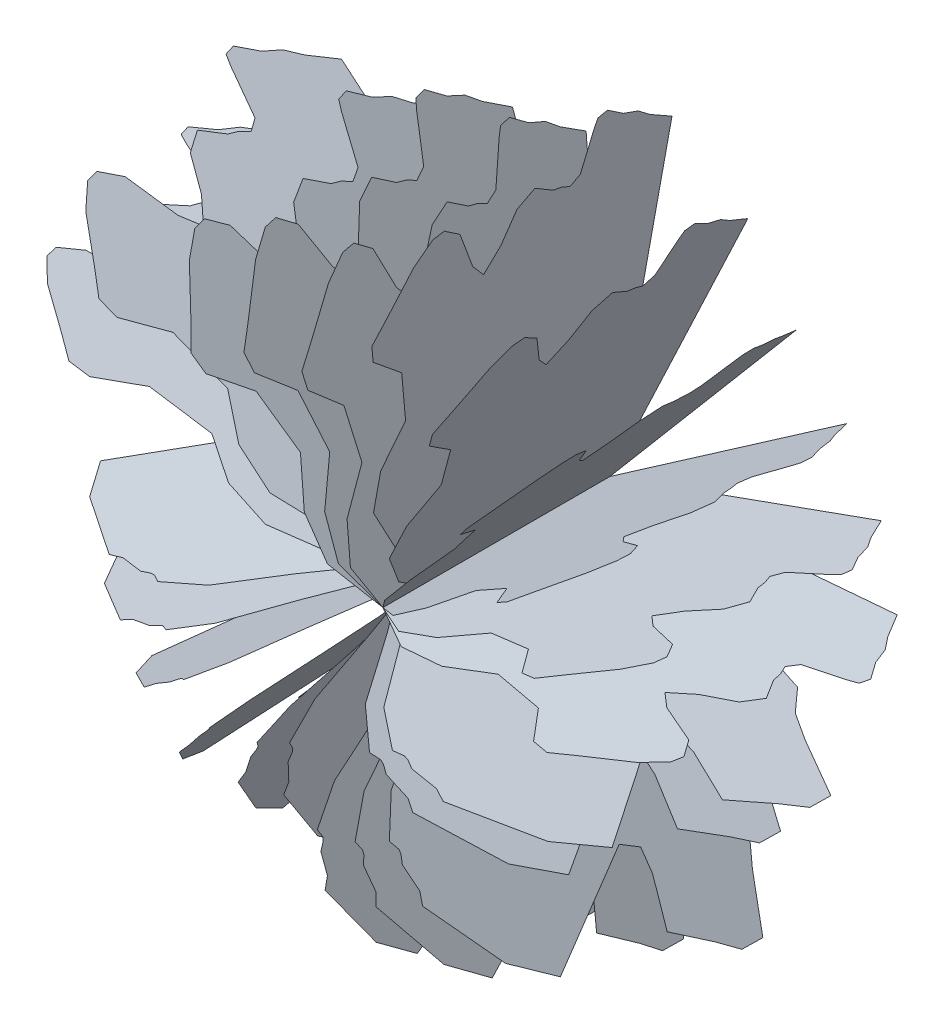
SolidWorks part; units mm, degrees
ref_plane "Front Plane" through (0, 0, 0) normal (0, 0, 1) x (1, 0, 0)
ref_plane "Top Plane" through (0, 0, 0) normal (0, 1, 0) x (1, 0, 0)
ref_plane "Right Plane" through (0, 0, 0) normal (1, 0, 0) x (0, 0, -1)
ref_plane "Plane1" through (25.384, -21.4943, 0) normal (0.7632, -0.6462, 0) x (0, 0, -1)
sketch "Sketch1" plane through (25.384, -21.4943, 0) normal (0.7632, -0.6462, 0) x (0, 0, -1)
  line L0 (-159.9173, 52.2955) -> (-110.809, -28.5095)
  line L1 (-110.809, -28.5095) -> (-61.5155, -70.8588)
  line L2 (-61.5155, -70.8588) -> (-72.0441, -99.0921)
  line L3 (-72.0441, -99.0921) -> (-128.3149, -144.876)
  line L4 (-128.3149, -144.876) -> (-205.5747, -201.1164)
  line L5 (-205.5747, -201.1164) -> (-226.6435, -234.5912)
  line L6 (-226.6435, -234.5912) -> (-236.1321, -249.6671)
  line L7 (-236.1321, -249.6671) -> (-228.7832, -262.4161)
  line L8 (-228.7832, -262.4161) -> (-228.7749, -268.1552)
  line L9 (-228.7749, -268.1552) -> (-233.0466, -279.6201)
  line L10 (-233.0466, -279.6201) -> (-225.8445, -314.1837)
  line L11 (-225.8445, -314.1837) -> (-230.772, -330.6846)
  line L12 (-230.772, -330.6846) -> (-228.078, -334.5422)
  line L13 (-228.078, -334.5422) -> (-221.2419, -344.3309)
  line L14 (-221.2419, -344.3309) -> (-159.963, -432.0771)
  line L15 (-159.963, -432.0771) -> (-99.8786, -475.5205)
  line L16 (-99.8786, -475.5205) -> (45.4329, -380.4379)
  line L17 (45.4329, -380.4379) -> (70.408, -394.9623)
  line L18 (70.408, -394.9623) -> (70.5248, -427.1845)
  line L19 (70.5248, -427.1845) -> (56.4876, -491.5695)
  line L20 (56.4876, -491.5695) -> (110.2067, -528.1195)
  line L21 (110.2067, -528.1195) -> (138.9491, -550.0691)
  line L22 (138.9491, -550.0691) -> (171.2269, -550.4743)
  line L23 (171.2269, -550.4743) -> (195.9591, -478.7357)
  line L24 (195.9591, -478.7357) -> (210.1304, -446.511)
  line L25 (210.1304, -446.511) -> (236.1321, -421.7251)
  line L26 (236.1321, -421.7251) -> (236.1321, 380.4546)
  line L27 (236.1321, 380.4546) -> (236.1321, 426.0548)
  line L28 (236.1321, 426.0548) -> (197.7901, 450.0431)
  line L29 (197.7901, 450.0431) -> (176.4891, 467.2599)
  line L30 (176.4891, 467.2599) -> (151.7295, 477.4388)
  line L31 (151.7295, 477.4388) -> (123.4376, 498.0046)
  line L32 (123.4376, 498.0046) -> (109.3729, 494.3557)
  line L33 (109.3729, 494.3557) -> (105.9135, 480.3923)
  line L34 (105.9135, 480.3923) -> (95.6147, 417.5599)
  line L35 (95.6147, 417.5599) -> (81.5753, 406.9565)
  line L36 (81.5753, 406.9565) -> (67.4773, 413.7893)
  line L37 (67.4773, 413.7893) -> (53.4036, 417.1321)
  line L38 (53.4036, 417.1321) -> (21.7401, 437.6934)
  line L39 (21.7401, 437.6934) -> (-2.7565, 420.0423)
  line L40 (-2.7565, 420.0423) -> (-20.1735, 374.6204)
  line L41 (-20.1735, 374.6204) -> (-41.1314, 343.0823)
  line L42 (-41.1314, 343.0823) -> (-62.1738, 367.2764)
  line L43 (-62.1738, 367.2764) -> (-93.6962, 432.9968)
  line L44 (-93.6962, 432.9968) -> (-121.5999, 453.5027)
  line L45 (-121.5999, 453.5027) -> (-139.0074, 449.8463)
  line L46 (-139.0074, 449.8463) -> (-163.3607, 421.8671)
  line L47 (-163.3607, 421.8671) -> (-194.6789, 362.6158)
  line L48 (-194.6789, 362.6158) -> (-212.0825, 331.2299)
  line L49 (-212.0825, 331.2299) -> (-205.1542, 303.4944)
  line L50 (-205.1542, 303.4944) -> (-152.9209, 258.6149)
  line L51 (-152.9209, 258.6149) -> (-131.9461, 174.9538)
  line L52 (-131.9461, 174.9538) -> (-159.9114, 115.3737)
  line L53 (-159.9114, 115.3737) -> (-159.9173, 52.2955)
surface "Surface-Plane1" sketch "Sketch1"
ref_plane "Plane2" through (3.1514, -37.9805, 0) normal (0.0827, -0.9966, 0) x (-0.9966, -0.0827, 0)
sketch "Sketch2" plane through (3.1514, -37.9805, 0) normal (0.0827, -0.9966, 0) x (-0.9966, -0.0827, 0)
  line L0 (-81.8591, -159.9173) -> (-1.0541, -110.809)
  line L1 (-1.0541, -110.809) -> (41.2952, -61.5155)
  line L2 (41.2952, -61.5155) -> (69.5285, -72.0441)
  line L3 (69.5285, -72.0441) -> (115.3124, -128.3149)
  line L4 (115.3124, -128.3149) -> (171.5528, -205.5747)
  line L5 (171.5528, -205.5747) -> (205.0276, -226.6435)
  line L6 (205.0276, -226.6435) -> (220.1035, -236.1321)
  line L7 (220.1035, -236.1321) -> (232.8525, -228.7832)
  line L8 (232.8525, -228.7832) -> (238.5916, -228.7749)
  line L9 (238.5916, -228.7749) -> (250.0565, -233.0466)
  line L10 (250.0565, -233.0466) -> (284.6201, -225.8445)
  line L11 (284.6201, -225.8445) -> (301.121, -230.772)
  line L12 (301.121, -230.772) -> (304.9786, -228.078)
  line L13 (304.9786, -228.078) -> (314.7673, -221.2419)
  line L14 (314.7673, -221.2419) -> (402.5135, -159.963)
  line L15 (402.5135, -159.963) -> (445.9569, -99.8786)
  line L16 (445.9569, -99.8786) -> (350.8743, 45.4329)
  line L17 (350.8743, 45.4329) -> (365.3987, 70.408)
  line L18 (365.3987, 70.408) -> (397.6209, 70.5248)
  line L19 (397.6209, 70.5248) -> (462.0059, 56.4876)
  line L20 (462.0059, 56.4876) -> (498.5559, 110.2067)
  line L21 (498.5559, 110.2067) -> (520.5055, 138.9491)
  line L22 (520.5055, 138.9491) -> (520.9107, 171.2269)
  line L23 (520.9107, 171.2269) -> (449.1721, 195.9591)
  line L24 (449.1721, 195.9591) -> (416.9474, 210.1304)
  line L25 (416.9474, 210.1304) -> (392.1615, 236.1321)
  line L26 (392.1615, 236.1321) -> (-410.0182, 236.1321)
  line L27 (-410.0182, 236.1321) -> (-455.6184, 236.1321)
  line L28 (-455.6184, 236.1321) -> (-479.6068, 197.7901)
  line L29 (-479.6068, 197.7901) -> (-496.8235, 176.4891)
  line L30 (-496.8235, 176.4891) -> (-507.0024, 151.7295)
  line L31 (-507.0024, 151.7295) -> (-527.5682, 123.4376)
  line L32 (-527.5682, 123.4376) -> (-523.9194, 109.3729)
  line L33 (-523.9194, 109.3729) -> (-509.9559, 105.9135)
  line L34 (-509.9559, 105.9135) -> (-447.1236, 95.6147)
  line L35 (-447.1236, 95.6147) -> (-436.5201, 81.5753)
  line L36 (-436.5201, 81.5753) -> (-443.3529, 67.4773)
  line L37 (-443.3529, 67.4773) -> (-446.6957, 53.4036)
  line L38 (-446.6957, 53.4036) -> (-467.257, 21.7401)
  line L39 (-467.257, 21.7401) -> (-449.6059, -2.7565)
  line L40 (-449.6059, -2.7565) -> (-404.1841, -20.1735)
  line L41 (-404.1841, -20.1735) -> (-372.6459, -41.1314)
  line L42 (-372.6459, -41.1314) -> (-396.84, -62.1738)
  line L43 (-396.84, -62.1738) -> (-462.5604, -93.6962)
  line L44 (-462.5604, -93.6962) -> (-483.0663, -121.5999)
  line L45 (-483.0663, -121.5999) -> (-479.4099, -139.0074)
  line L46 (-479.4099, -139.0074) -> (-451.4307, -163.3607)
  line L47 (-451.4307, -163.3607) -> (-392.1794, -194.6789)
  line L48 (-392.1794, -194.6789) -> (-360.7935, -212.0825)
  line L49 (-360.7935, -212.0825) -> (-333.058, -205.1542)
  line L50 (-333.058, -205.1542) -> (-288.1785, -152.9209)
  line L51 (-288.1785, -152.9209) -> (-204.5174, -131.9461)
  line L52 (-204.5174, -131.9461) -> (-144.9373, -159.9114)
  line L53 (-144.9373, -159.9114) -> (-81.8591, -159.9173)
surface "Surface-Plane2" sketch "Sketch2"
ref_plane "Plane3" through (24.2269, -11.4297, 0) normal (0.9044, -0.4267, 0) x (0, 0, -1)
sketch "Sketch3" plane through (24.2269, -11.4297, 0) normal (0.9044, -0.4267, 0) x (0, 0, -1)
  line L0 (-159.9173, 98.6563) -> (-110.809, 17.8513)
  line L1 (-110.809, 17.8513) -> (-61.5155, -24.4981)
  line L2 (-61.5155, -24.4981) -> (-72.0441, -52.7313)
  line L3 (-72.0441, -52.7313) -> (-128.3149, -98.5152)
  line L4 (-128.3149, -98.5152) -> (-205.5747, -154.7556)
  line L5 (-205.5747, -154.7556) -> (-226.6435, -188.2305)
  line L6 (-226.6435, -188.2305) -> (-236.1321, -203.3063)
  line L7 (-236.1321, -203.3063) -> (-228.7832, -216.0553)
  line L8 (-228.7832, -216.0553) -> (-228.7749, -221.7945)
  line L9 (-228.7749, -221.7945) -> (-233.0466, -233.2593)
  line L10 (-233.0466, -233.2593) -> (-225.8445, -267.8229)
  line L11 (-225.8445, -267.8229) -> (-230.772, -284.3239)
  line L12 (-230.772, -284.3239) -> (-228.078, -288.1814)
  line L13 (-228.078, -288.1814) -> (-221.2419, -297.9701)
  line L14 (-221.2419, -297.9701) -> (-159.963, -385.7163)
  line L15 (-159.963, -385.7163) -> (-99.8786, -429.1597)
  line L16 (-99.8786, -429.1597) -> (45.4329, -334.0771)
  line L17 (45.4329, -334.0771) -> (70.408, -348.6016)
  line L18 (70.408, -348.6016) -> (70.5248, -380.8237)
  line L19 (70.5248, -380.8237) -> (56.4876, -445.2087)
  line L20 (56.4876, -445.2087) -> (110.2067, -481.7587)
  line L21 (110.2067, -481.7587) -> (138.9491, -503.7083)
  line L22 (138.9491, -503.7083) -> (171.2269, -504.1136)
  line L23 (171.2269, -504.1136) -> (195.9591, -432.375)
  line L24 (195.9591, -432.375) -> (210.1304, -400.1502)
  line L25 (210.1304, -400.1502) -> (236.1321, -375.3644)
  line L26 (236.1321, -375.3644) -> (236.1321, 426.8154)
  line L27 (236.1321, 426.8154) -> (236.1321, 472.4156)
  line L28 (236.1321, 472.4156) -> (197.7901, 496.4039)
  line L29 (197.7901, 496.4039) -> (176.4891, 513.6207)
  line L30 (176.4891, 513.6207) -> (151.7295, 523.7996)
  line L31 (151.7295, 523.7996) -> (123.4376, 544.3654)
  line L32 (123.4376, 544.3654) -> (109.3729, 540.7165)
  line L33 (109.3729, 540.7165) -> (105.9135, 526.7531)
  line L34 (105.9135, 526.7531) -> (95.6147, 463.9207)
  line L35 (95.6147, 463.9207) -> (81.5753, 453.3173)
  line L36 (81.5753, 453.3173) -> (67.4773, 460.15)
  line L37 (67.4773, 460.15) -> (53.4036, 463.4929)
  line L38 (53.4036, 463.4929) -> (21.7401, 484.0542)
  line L39 (21.7401, 484.0542) -> (-2.7565, 466.403)
  line L40 (-2.7565, 466.403) -> (-20.1735, 420.9812)
  line L41 (-20.1735, 420.9812) -> (-41.1314, 389.4431)
  line L42 (-41.1314, 389.4431) -> (-62.1738, 413.6372)
  line L43 (-62.1738, 413.6372) -> (-93.6962, 479.3576)
  line L44 (-93.6962, 479.3576) -> (-121.5999, 499.8635)
  line L45 (-121.5999, 499.8635) -> (-139.0074, 496.2071)
  line L46 (-139.0074, 496.2071) -> (-163.3607, 468.2279)
  line L47 (-163.3607, 468.2279) -> (-194.6789, 408.9765)
  line L48 (-194.6789, 408.9765) -> (-212.0825, 377.5907)
  line L49 (-212.0825, 377.5907) -> (-205.1542, 349.8552)
  line L50 (-205.1542, 349.8552) -> (-152.9209, 304.9757)
  line L51 (-152.9209, 304.9757) -> (-131.9461, 221.3145)
  line L52 (-131.9461, 221.3145) -> (-159.9114, 161.7345)
  line L53 (-159.9114, 161.7345) -> (-159.9173, 98.6563)
surface "Surface-Plane3" sketch "Sketch3"
ref_plane "Plane4" through (-9.3046, -6.4532, 0) normal (0.8217, 0.5699, 0) x (0, 0, -1)
sketch "Sketch4" plane through (-9.3046, -6.4532, 0) normal (0.8217, 0.5699, 0) x (0, 0, -1)
  line L0 (-159.9173, 35.4615) -> (-110.809, -45.3435)
  line L1 (-110.809, -45.3435) -> (-61.5155, -87.6928)
  line L2 (-61.5155, -87.6928) -> (-72.0441, -115.9261)
  line L3 (-72.0441, -115.9261) -> (-128.3149, -161.71)
  line L4 (-128.3149, -161.71) -> (-205.5747, -217.9504)
  line L5 (-205.5747, -217.9504) -> (-226.6435, -251.4252)
  line L6 (-226.6435, -251.4252) -> (-236.1321, -266.5011)
  line L7 (-236.1321, -266.5011) -> (-228.7832, -279.2501)
  line L8 (-228.7832, -279.2501) -> (-228.7749, -284.9892)
  line L9 (-228.7749, -284.9892) -> (-233.0466, -296.454)
  line L10 (-233.0466, -296.454) -> (-225.8445, -331.0177)
  line L11 (-225.8445, -331.0177) -> (-230.772, -347.5186)
  line L12 (-230.772, -347.5186) -> (-228.078, -351.3762)
  line L13 (-228.078, -351.3762) -> (-221.2419, -361.1649)
  line L14 (-221.2419, -361.1649) -> (-159.963, -448.911)
  line L15 (-159.963, -448.911) -> (-99.8786, -492.3545)
  line L16 (-99.8786, -492.3545) -> (45.4329, -397.2719)
  line L17 (45.4329, -397.2719) -> (70.408, -411.7963)
  line L18 (70.408, -411.7963) -> (70.5248, -444.0185)
  line L19 (70.5248, -444.0185) -> (56.4876, -508.4035)
  line L20 (56.4876, -508.4035) -> (110.2067, -544.9535)
  line L21 (110.2067, -544.9535) -> (138.9491, -566.9031)
  line L22 (138.9491, -566.9031) -> (171.2269, -567.3083)
  line L23 (171.2269, -567.3083) -> (195.9591, -495.5697)
  line L24 (195.9591, -495.5697) -> (210.1304, -463.345)
  line L25 (210.1304, -463.345) -> (236.1321, -438.5591)
  line L26 (236.1321, -438.5591) -> (236.1321, 363.6206)
  line L27 (236.1321, 363.6206) -> (236.1321, 409.2208)
  line L28 (236.1321, 409.2208) -> (197.7901, 433.2092)
  line L29 (197.7901, 433.2092) -> (176.4891, 450.4259)
  line L30 (176.4891, 450.4259) -> (151.7295, 460.6048)
  line L31 (151.7295, 460.6048) -> (123.4376, 481.1706)
  line L32 (123.4376, 481.1706) -> (109.3729, 477.5218)
  line L33 (109.3729, 477.5218) -> (105.9135, 463.5583)
  line L34 (105.9135, 463.5583) -> (95.6147, 400.726)
  line L35 (95.6147, 400.726) -> (81.5753, 390.1225)
  line L36 (81.5753, 390.1225) -> (67.4773, 396.9553)
  line L37 (67.4773, 396.9553) -> (53.4036, 400.2981)
  line L38 (53.4036, 400.2981) -> (21.7401, 420.8594)
  line L39 (21.7401, 420.8594) -> (-2.7565, 403.2083)
  line L40 (-2.7565, 403.2083) -> (-20.1735, 357.7865)
  line L41 (-20.1735, 357.7865) -> (-41.1314, 326.2483)
  line L42 (-41.1314, 326.2483) -> (-62.1738, 350.4424)
  line L43 (-62.1738, 350.4424) -> (-93.6962, 416.1628)
  line L44 (-93.6962, 416.1628) -> (-121.5999, 436.6687)
  line L45 (-121.5999, 436.6687) -> (-139.0074, 433.0123)
  line L46 (-139.0074, 433.0123) -> (-163.3607, 405.0331)
  line L47 (-163.3607, 405.0331) -> (-194.6789, 345.7818)
  line L48 (-194.6789, 345.7818) -> (-212.0825, 314.3959)
  line L49 (-212.0825, 314.3959) -> (-205.1542, 286.6604)
  line L50 (-205.1542, 286.6604) -> (-152.9209, 241.7809)
  line L51 (-152.9209, 241.7809) -> (-131.9461, 158.1198)
  line L52 (-131.9461, 158.1198) -> (-159.9114, 98.5397)
  line L53 (-159.9114, 98.5397) -> (-159.9173, 35.4615)
surface "Surface-Plane4" sketch "Sketch4"
ref_plane "Plane5" through (21.3537, -30.7891, 0) normal (0.5699, -0.8217, 0) x (-0.8217, -0.5699, 0)
sketch "Sketch5" plane through (21.3537, -30.7891, 0) normal (0.5699, -0.8217, 0) x (-0.8217, -0.5699, 0)
  line L0 (-61.6074, -159.9173) -> (19.1975, -110.809)
  line L1 (19.1975, -110.809) -> (61.5469, -61.5155)
  line L2 (61.5469, -61.5155) -> (89.7802, -72.0441)
  line L3 (89.7802, -72.0441) -> (135.564, -128.3149)
  line L4 (135.564, -128.3149) -> (191.8045, -205.5747)
  line L5 (191.8045, -205.5747) -> (225.2793, -226.6435)
  line L6 (225.2793, -226.6435) -> (240.3552, -236.1321)
  line L7 (240.3552, -236.1321) -> (253.1042, -228.7832)
  line L8 (253.1042, -228.7832) -> (258.8433, -228.7749)
  line L9 (258.8433, -228.7749) -> (270.3081, -233.0466)
  line L10 (270.3081, -233.0466) -> (304.8717, -225.8445)
  line L11 (304.8717, -225.8445) -> (321.3727, -230.772)
  line L12 (321.3727, -230.772) -> (325.2303, -228.078)
  line L13 (325.2303, -228.078) -> (335.019, -221.2419)
  line L14 (335.019, -221.2419) -> (422.7651, -159.963)
  line L15 (422.7651, -159.963) -> (466.2086, -99.8786)
  line L16 (466.2086, -99.8786) -> (371.1259, 45.4329)
  line L17 (371.1259, 45.4329) -> (385.6504, 70.408)
  line L18 (385.6504, 70.408) -> (417.8726, 70.5248)
  line L19 (417.8726, 70.5248) -> (482.2576, 56.4876)
  line L20 (482.2576, 56.4876) -> (518.8076, 110.2067)
  line L21 (518.8076, 110.2067) -> (540.7572, 138.9491)
  line L22 (540.7572, 138.9491) -> (541.1624, 171.2269)
  line L23 (541.1624, 171.2269) -> (469.4238, 195.9591)
  line L24 (469.4238, 195.9591) -> (437.1991, 210.1304)
  line L25 (437.1991, 210.1304) -> (412.4132, 236.1321)
  line L26 (412.4132, 236.1321) -> (-389.7665, 236.1321)
  line L27 (-389.7665, 236.1321) -> (-435.3667, 236.1321)
  line L28 (-435.3667, 236.1321) -> (-459.3551, 197.7901)
  line L29 (-459.3551, 197.7901) -> (-476.5718, 176.4891)
  line L30 (-476.5718, 176.4891) -> (-486.7507, 151.7295)
  line L31 (-486.7507, 151.7295) -> (-507.3165, 123.4376)
  line L32 (-507.3165, 123.4376) -> (-503.6677, 109.3729)
  line L33 (-503.6677, 109.3729) -> (-489.7042, 105.9135)
  line L34 (-489.7042, 105.9135) -> (-426.8719, 95.6147)
  line L35 (-426.8719, 95.6147) -> (-416.2684, 81.5753)
  line L36 (-416.2684, 81.5753) -> (-423.1012, 67.4773)
  line L37 (-423.1012, 67.4773) -> (-426.444, 53.4036)
  line L38 (-426.444, 53.4036) -> (-447.0053, 21.7401)
  line L39 (-447.0053, 21.7401) -> (-429.3542, -2.7565)
  line L40 (-429.3542, -2.7565) -> (-383.9324, -20.1735)
  line L41 (-383.9324, -20.1735) -> (-352.3942, -41.1314)
  line L42 (-352.3942, -41.1314) -> (-376.5883, -62.1738)
  line L43 (-376.5883, -62.1738) -> (-442.3087, -93.6962)
  line L44 (-442.3087, -93.6962) -> (-462.8146, -121.5999)
  line L45 (-462.8146, -121.5999) -> (-459.1582, -139.0074)
  line L46 (-459.1582, -139.0074) -> (-431.1791, -163.3607)
  line L47 (-431.1791, -163.3607) -> (-371.9277, -194.6789)
  line L48 (-371.9277, -194.6789) -> (-340.5418, -212.0825)
  line L49 (-340.5418, -212.0825) -> (-312.8063, -205.1542)
  line L50 (-312.8063, -205.1542) -> (-267.9269, -152.9209)
  line L51 (-267.9269, -152.9209) -> (-184.2657, -131.9461)
  line L52 (-184.2657, -131.9461) -> (-124.6856, -159.9114)
  line L53 (-124.6856, -159.9114) -> (-61.6074, -159.9173)
surface "Surface-Plane5" sketch "Sketch5"
ref_plane "Plane6" through (13.216, -36.8234, 0) normal (0.3378, -0.9412, 0) x (-0.9412, -0.3378, 0)
sketch "Sketch6" plane through (13.216, -36.8234, 0) normal (0.3378, -0.9412, 0) x (-0.9412, -0.3378, 0)
  line L0 (-71.691, -159.9173) -> (9.1139, -110.809)
  line L1 (9.1139, -110.809) -> (51.4633, -61.5155)
  line L2 (51.4633, -61.5155) -> (79.6966, -72.0441)
  line L3 (79.6966, -72.0441) -> (125.4804, -128.3149)
  line L4 (125.4804, -128.3149) -> (181.7209, -205.5747)
  line L5 (181.7209, -205.5747) -> (215.1957, -226.6435)
  line L6 (215.1957, -226.6435) -> (230.2716, -236.1321)
  line L7 (230.2716, -236.1321) -> (243.0206, -228.7832)
  line L8 (243.0206, -228.7832) -> (248.7597, -228.7749)
  line L9 (248.7597, -228.7749) -> (260.2245, -233.0466)
  line L10 (260.2245, -233.0466) -> (294.7881, -225.8445)
  line L11 (294.7881, -225.8445) -> (311.2891, -230.772)
  line L12 (311.2891, -230.772) -> (315.1467, -228.078)
  line L13 (315.1467, -228.078) -> (324.9354, -221.2419)
  line L14 (324.9354, -221.2419) -> (412.6815, -159.963)
  line L15 (412.6815, -159.963) -> (456.125, -99.8786)
  line L16 (456.125, -99.8786) -> (361.0423, 45.4329)
  line L17 (361.0423, 45.4329) -> (375.5668, 70.408)
  line L18 (375.5668, 70.408) -> (407.789, 70.5248)
  line L19 (407.789, 70.5248) -> (472.174, 56.4876)
  line L20 (472.174, 56.4876) -> (508.724, 110.2067)
  line L21 (508.724, 110.2067) -> (530.6736, 138.9491)
  line L22 (530.6736, 138.9491) -> (531.0788, 171.2269)
  line L23 (531.0788, 171.2269) -> (459.3402, 195.9591)
  line L24 (459.3402, 195.9591) -> (427.1155, 210.1304)
  line L25 (427.1155, 210.1304) -> (402.3296, 236.1321)
  line L26 (402.3296, 236.1321) -> (-399.8501, 236.1321)
  line L27 (-399.8501, 236.1321) -> (-445.4503, 236.1321)
  line L28 (-445.4503, 236.1321) -> (-469.4387, 197.7901)
  line L29 (-469.4387, 197.7901) -> (-486.6554, 176.4891)
  line L30 (-486.6554, 176.4891) -> (-496.8343, 151.7295)
  line L31 (-496.8343, 151.7295) -> (-517.4001, 123.4376)
  line L32 (-517.4001, 123.4376) -> (-513.7513, 109.3729)
  line L33 (-513.7513, 109.3729) -> (-499.7878, 105.9135)
  line L34 (-499.7878, 105.9135) -> (-436.9555, 95.6147)
  line L35 (-436.9555, 95.6147) -> (-426.352, 81.5753)
  line L36 (-426.352, 81.5753) -> (-433.1848, 67.4773)
  line L37 (-433.1848, 67.4773) -> (-436.5276, 53.4036)
  line L38 (-436.5276, 53.4036) -> (-457.0889, 21.7401)
  line L39 (-457.0889, 21.7401) -> (-439.4378, -2.7565)
  line L40 (-439.4378, -2.7565) -> (-394.016, -20.1735)
  line L41 (-394.016, -20.1735) -> (-362.4778, -41.1314)
  line L42 (-362.4778, -41.1314) -> (-386.6719, -62.1738)
  line L43 (-386.6719, -62.1738) -> (-452.3923, -93.6962)
  line L44 (-452.3923, -93.6962) -> (-472.8982, -121.5999)
  line L45 (-472.8982, -121.5999) -> (-469.2418, -139.0074)
  line L46 (-469.2418, -139.0074) -> (-441.2627, -163.3607)
  line L47 (-441.2627, -163.3607) -> (-382.0113, -194.6789)
  line L48 (-382.0113, -194.6789) -> (-350.6254, -212.0825)
  line L49 (-350.6254, -212.0825) -> (-322.8899, -205.1542)
  line L50 (-322.8899, -205.1542) -> (-278.0105, -152.9209)
  line L51 (-278.0105, -152.9209) -> (-194.3493, -131.9461)
  line L52 (-194.3493, -131.9461) -> (-134.7692, -159.9114)
  line L53 (-134.7692, -159.9114) -> (-71.691, -159.9173)
surface "Surface-Plane6" sketch "Sketch6"
ref_plane "Plane7" through (-1.1669, -0.4188, 0) normal (0.9412, 0.3378, 0) x (0, 0, -1)
sketch "Sketch7" plane through (-1.1669, -0.4188, 0) normal (0.9412, 0.3378, 0) x (0, 0, -1)
  line L0 (-159.9173, 33.8075) -> (-110.809, -46.9974)
  line L1 (-110.809, -46.9974) -> (-61.5155, -89.3468)
  line L2 (-61.5155, -89.3468) -> (-72.0441, -117.5801)
  line L3 (-72.0441, -117.5801) -> (-128.3149, -163.3639)
  line L4 (-128.3149, -163.3639) -> (-205.5747, -219.6044)
  line L5 (-205.5747, -219.6044) -> (-226.6435, -253.0792)
  line L6 (-226.6435, -253.0792) -> (-236.1321, -268.155)
  line L7 (-236.1321, -268.155) -> (-228.7832, -280.904)
  line L8 (-228.7832, -280.904) -> (-228.7749, -286.6432)
  line L9 (-228.7749, -286.6432) -> (-233.0466, -298.108)
  line L10 (-233.0466, -298.108) -> (-225.8445, -332.6716)
  line L11 (-225.8445, -332.6716) -> (-230.772, -349.1726)
  line L12 (-230.772, -349.1726) -> (-221.2419, -362.8188)
  line L13 (-221.2419, -362.8188) -> (-159.963, -450.565)
  line L14 (-159.963, -450.565) -> (-99.8786, -494.0085)
  line L15 (-99.8786, -494.0085) -> (45.4329, -398.9258)
  line L16 (45.4329, -398.9258) -> (70.408, -413.4503)
  line L17 (70.408, -413.4503) -> (70.5248, -445.6724)
  line L18 (70.5248, -445.6724) -> (56.4876, -510.0574)
  line L19 (56.4876, -510.0574) -> (110.2067, -546.6075)
  line L20 (110.2067, -546.6075) -> (138.9491, -568.5571)
  line L21 (138.9491, -568.5571) -> (171.2269, -568.9623)
  line L22 (171.2269, -568.9623) -> (195.9591, -497.2237)
  line L23 (195.9591, -497.2237) -> (210.1304, -464.9989)
  line L24 (210.1304, -464.9989) -> (236.1321, -440.2131)
  line L25 (236.1321, -440.2131) -> (236.1321, 361.9666)
  line L26 (236.1321, 361.9666) -> (236.1321, 407.5669)
  line L27 (236.1321, 407.5669) -> (197.7901, 431.5552)
  line L28 (197.7901, 431.5552) -> (176.4891, 448.7719)
  line L29 (176.4891, 448.7719) -> (151.7295, 458.9508)
  line L30 (151.7295, 458.9508) -> (123.4376, 479.5166)
  line L31 (123.4376, 479.5166) -> (109.3729, 475.8678)
  line L32 (109.3729, 475.8678) -> (105.9135, 461.9043)
  line L33 (105.9135, 461.9043) -> (95.6147, 399.072)
  line L34 (95.6147, 399.072) -> (81.5753, 388.4686)
  line L35 (81.5753, 388.4686) -> (67.4773, 395.3013)
  line L36 (67.4773, 395.3013) -> (53.4036, 398.6442)
  line L37 (53.4036, 398.6442) -> (21.7401, 419.2055)
  line L38 (21.7401, 419.2055) -> (-2.7565, 401.5543)
  line L39 (-2.7565, 401.5543) -> (-20.1735, 356.1325)
  line L40 (-20.1735, 356.1325) -> (-41.1314, 324.5943)
  line L41 (-41.1314, 324.5943) -> (-62.1738, 348.7884)
  line L42 (-62.1738, 348.7884) -> (-93.6962, 414.5089)
  line L43 (-93.6962, 414.5089) -> (-121.5999, 435.0147)
  line L44 (-121.5999, 435.0147) -> (-139.0074, 431.3583)
  line L45 (-139.0074, 431.3583) -> (-163.3607, 403.3792)
  line L46 (-163.3607, 403.3792) -> (-194.6789, 344.1278)
  line L47 (-194.6789, 344.1278) -> (-212.0825, 312.742)
  line L48 (-212.0825, 312.742) -> (-205.1542, 285.0065)
  line L49 (-205.1542, 285.0065) -> (-152.9209, 240.127)
  line L50 (-152.9209, 240.127) -> (-131.9461, 156.4658)
  line L51 (-131.9461, 156.4658) -> (-159.9114, 96.8857)
  line L52 (-159.9114, 96.8857) -> (-159.9173, 33.8075)
surface "Surface-Plane7" sketch "Sketch7"
ref_plane "Plane8" through (-12.1778, -25.8126, 0) normal (0.4267, 0.9044, 0) x (0.9044, -0.4267, 0)
sketch "Sketch8" plane through (-12.1778, -25.8126, 0) normal (0.4267, 0.9044, 0) x (0.9044, -0.4267, 0)
  line L0 (-125.645, -159.9173) -> (-44.84, -110.809)
  line L1 (-44.84, -110.809) -> (-2.4906, -61.5155)
  line L2 (-2.4906, -61.5155) -> (25.7426, -72.0441)
  line L3 (25.7426, -72.0441) -> (71.5265, -128.3149)
  line L4 (71.5265, -128.3149) -> (127.7669, -205.5747)
  line L5 (127.7669, -205.5747) -> (161.2418, -226.6435)
  line L6 (161.2418, -226.6435) -> (176.3176, -236.1321)
  line L7 (176.3176, -236.1321) -> (189.0666, -228.7832)
  line L8 (189.0666, -228.7832) -> (194.8058, -228.7749)
  line L9 (194.8058, -228.7749) -> (206.2706, -233.0466)
  line L10 (206.2706, -233.0466) -> (240.8342, -225.8445)
  line L11 (240.8342, -225.8445) -> (257.3352, -230.772)
  line L12 (257.3352, -230.772) -> (261.1927, -228.078)
  line L13 (261.1927, -228.078) -> (270.9814, -221.2419)
  line L14 (270.9814, -221.2419) -> (358.7276, -159.963)
  line L15 (358.7276, -159.963) -> (402.171, -99.8786)
  line L16 (402.171, -99.8786) -> (307.0884, 45.4329)
  line L17 (307.0884, 45.4329) -> (321.6129, 70.408)
  line L18 (321.6129, 70.408) -> (353.835, 70.5248)
  line L19 (353.835, 70.5248) -> (418.22, 56.4876)
  line L20 (418.22, 56.4876) -> (454.77, 110.2067)
  line L21 (454.77, 110.2067) -> (476.7196, 138.9491)
  line L22 (476.7196, 138.9491) -> (477.1249, 171.2269)
  line L23 (477.1249, 171.2269) -> (405.3863, 195.9591)
  line L24 (405.3863, 195.9591) -> (373.1615, 210.1304)
  line L25 (373.1615, 210.1304) -> (348.3757, 236.1321)
  line L26 (348.3757, 236.1321) -> (-453.8041, 236.1321)
  line L27 (-453.8041, 236.1321) -> (-499.4043, 236.1321)
  line L28 (-499.4043, 236.1321) -> (-523.3926, 197.7901)
  line L29 (-523.3926, 197.7901) -> (-540.6094, 176.4891)
  line L30 (-540.6094, 176.4891) -> (-550.7883, 151.7295)
  line L31 (-550.7883, 151.7295) -> (-571.3541, 123.4376)
  line L32 (-571.3541, 123.4376) -> (-567.7052, 109.3729)
  line L33 (-567.7052, 109.3729) -> (-553.7418, 105.9135)
  line L34 (-553.7418, 105.9135) -> (-490.9094, 95.6147)
  line L35 (-490.9094, 95.6147) -> (-480.306, 81.5753)
  line L36 (-480.306, 81.5753) -> (-487.1387, 67.4773)
  line L37 (-487.1387, 67.4773) -> (-490.4816, 53.4036)
  line L38 (-490.4816, 53.4036) -> (-511.0429, 21.7401)
  line L39 (-511.0429, 21.7401) -> (-493.3917, -2.7565)
  line L40 (-493.3917, -2.7565) -> (-447.9699, -20.1735)
  line L41 (-447.9699, -20.1735) -> (-416.4318, -41.1314)
  line L42 (-416.4318, -41.1314) -> (-440.6259, -62.1738)
  line L43 (-440.6259, -62.1738) -> (-506.3463, -93.6962)
  line L44 (-506.3463, -93.6962) -> (-526.8521, -121.5999)
  line L45 (-526.8521, -121.5999) -> (-523.1958, -139.0074)
  line L46 (-523.1958, -139.0074) -> (-495.2166, -163.3607)
  line L47 (-495.2166, -163.3607) -> (-435.9652, -194.6789)
  line L48 (-435.9652, -194.6789) -> (-404.5794, -212.0825)
  line L49 (-404.5794, -212.0825) -> (-376.8439, -205.1542)
  line L50 (-376.8439, -205.1542) -> (-331.9644, -152.9209)
  line L51 (-331.9644, -152.9209) -> (-248.3032, -131.9461)
  line L52 (-248.3032, -131.9461) -> (-188.7232, -159.9114)
  line L53 (-188.7232, -159.9114) -> (-125.645, -159.9173)
surface "Surface-Plane8" sketch "Sketch8"
ref_plane "Plane9" through (8.8977, 0.7383, 0) normal (0.9966, 0.0827, 0) x (0, 0, -1)
sketch "Sketch9" plane through (8.8977, 0.7383, 0) normal (0.9966, 0.0827, 0) x (0, 0, -1)
  line L0 (-159.9173, 34.8197) -> (-110.809, -45.9852)
  line L1 (-110.809, -45.9852) -> (-61.5155, -88.3346)
  line L2 (-61.5155, -88.3346) -> (-72.0441, -116.5679)
  line L3 (-72.0441, -116.5679) -> (-128.3149, -162.3517)
  line L4 (-128.3149, -162.3517) -> (-205.5747, -218.5922)
  line L5 (-205.5747, -218.5922) -> (-226.6435, -252.067)
  line L6 (-226.6435, -252.067) -> (-236.1321, -267.1428)
  line L7 (-236.1321, -267.1428) -> (-228.7832, -279.8918)
  line L8 (-228.7832, -279.8918) -> (-228.7749, -285.631)
  line L9 (-228.7749, -285.631) -> (-233.0466, -297.0958)
  line L10 (-233.0466, -297.0958) -> (-225.8445, -331.6594)
  line L11 (-225.8445, -331.6594) -> (-230.772, -348.1604)
  line L12 (-230.772, -348.1604) -> (-221.2419, -361.8066)
  line L13 (-221.2419, -361.8066) -> (-159.963, -449.5528)
  line L14 (-159.963, -449.5528) -> (-99.8786, -492.9963)
  line L15 (-99.8786, -492.9963) -> (45.4329, -397.9136)
  line L16 (45.4329, -397.9136) -> (70.408, -412.4381)
  line L17 (70.408, -412.4381) -> (70.5248, -444.6602)
  line L18 (70.5248, -444.6602) -> (56.4876, -509.0452)
  line L19 (56.4876, -509.0452) -> (110.2067, -545.5953)
  line L20 (110.2067, -545.5953) -> (138.9491, -567.5448)
  line L21 (138.9491, -567.5448) -> (171.2269, -567.9501)
  line L22 (171.2269, -567.9501) -> (195.9591, -496.2115)
  line L23 (195.9591, -496.2115) -> (210.1304, -463.9867)
  line L24 (210.1304, -463.9867) -> (236.1321, -439.2009)
  line L25 (236.1321, -439.2009) -> (236.1321, 362.9788)
  line L26 (236.1321, 362.9788) -> (236.1321, 408.5791)
  line L27 (236.1321, 408.5791) -> (197.7901, 432.5674)
  line L28 (197.7901, 432.5674) -> (176.4891, 449.7842)
  line L29 (176.4891, 449.7842) -> (151.7295, 459.9631)
  line L30 (151.7295, 459.9631) -> (123.4376, 480.5288)
  line L31 (123.4376, 480.5288) -> (109.3729, 476.88)
  line L32 (109.3729, 476.88) -> (105.9135, 462.9165)
  line L33 (105.9135, 462.9165) -> (95.6147, 400.0842)
  line L34 (95.6147, 400.0842) -> (81.5753, 389.4808)
  line L35 (81.5753, 389.4808) -> (67.4773, 396.3135)
  line L36 (67.4773, 396.3135) -> (53.4036, 399.6564)
  line L37 (53.4036, 399.6564) -> (21.7401, 420.2177)
  line L38 (21.7401, 420.2177) -> (-2.7565, 402.5665)
  line L39 (-2.7565, 402.5665) -> (-20.1735, 357.1447)
  line L40 (-20.1735, 357.1447) -> (-41.1314, 325.6066)
  line L41 (-41.1314, 325.6066) -> (-62.1738, 349.8007)
  line L42 (-62.1738, 349.8007) -> (-93.6962, 415.5211)
  line L43 (-93.6962, 415.5211) -> (-121.5999, 436.0269)
  line L44 (-121.5999, 436.0269) -> (-139.0074, 432.3706)
  line L45 (-139.0074, 432.3706) -> (-163.3607, 404.3914)
  line L46 (-163.3607, 404.3914) -> (-194.6789, 345.14)
  line L47 (-194.6789, 345.14) -> (-212.0825, 313.7542)
  line L48 (-212.0825, 313.7542) -> (-205.1542, 286.0187)
  line L49 (-205.1542, 286.0187) -> (-152.9209, 241.1392)
  line L50 (-152.9209, 241.1392) -> (-131.9461, 157.478)
  line L51 (-131.9461, 157.478) -> (-159.9114, 97.8979)
  line L52 (-159.9114, 97.8979) -> (-159.9173, 34.8197)
surface "Surface-Plane9" sketch "Sketch9"
ref_plane "Plane10" through (-13.3348, -15.7479, 0) normal (0.6462, 0.7632, 0) x (0.7632, -0.6462, 0)
sketch "Sketch10" plane through (-13.3348, -15.7479, 0) normal (0.6462, 0.7632, 0) x (0.7632, -0.6462, 0)
  line L0 (-137.978, -159.9173) -> (-57.1731, -110.809)
  line L1 (-57.1731, -110.809) -> (-14.8237, -61.5155)
  line L2 (-14.8237, -61.5155) -> (13.4096, -72.0441)
  line L3 (13.4096, -72.0441) -> (59.1934, -128.3149)
  line L4 (59.1934, -128.3149) -> (115.4339, -205.5747)
  line L5 (115.4339, -205.5747) -> (148.9087, -226.6435)
  line L6 (148.9087, -226.6435) -> (163.9845, -236.1321)
  line L7 (163.9845, -236.1321) -> (176.7335, -228.7832)
  line L8 (176.7335, -228.7832) -> (182.4727, -228.7749)
  line L9 (182.4727, -228.7749) -> (193.9375, -233.0466)
  line L10 (193.9375, -233.0466) -> (228.5011, -225.8445)
  line L11 (228.5011, -225.8445) -> (245.0021, -230.772)
  line L12 (245.0021, -230.772) -> (248.8596, -228.078)
  line L13 (248.8596, -228.078) -> (258.6483, -221.2419)
  line L14 (258.6483, -221.2419) -> (346.3945, -159.963)
  line L15 (346.3945, -159.963) -> (389.838, -99.8786)
  line L16 (389.838, -99.8786) -> (294.7553, 45.4329)
  line L17 (294.7553, 45.4329) -> (309.2798, 70.408)
  line L18 (309.2798, 70.408) -> (341.5019, 70.5248)
  line L19 (341.5019, 70.5248) -> (405.887, 56.4876)
  line L20 (405.887, 56.4876) -> (442.437, 110.2067)
  line L21 (442.437, 110.2067) -> (464.3866, 138.9491)
  line L22 (464.3866, 138.9491) -> (464.7918, 171.2269)
  line L23 (464.7918, 171.2269) -> (393.0532, 195.9591)
  line L24 (393.0532, 195.9591) -> (360.8284, 210.1304)
  line L25 (360.8284, 210.1304) -> (336.0426, 236.1321)
  line L26 (336.0426, 236.1321) -> (-466.1371, 236.1321)
  line L27 (-466.1371, 236.1321) -> (-511.7374, 236.1321)
  line L28 (-511.7374, 236.1321) -> (-535.7257, 197.7901)
  line L29 (-535.7257, 197.7901) -> (-552.9424, 176.4891)
  line L30 (-552.9424, 176.4891) -> (-563.1213, 151.7295)
  line L31 (-563.1213, 151.7295) -> (-583.6871, 123.4376)
  line L32 (-583.6871, 123.4376) -> (-580.0383, 109.3729)
  line L33 (-580.0383, 109.3729) -> (-566.0748, 105.9135)
  line L34 (-566.0748, 105.9135) -> (-503.2425, 95.6147)
  line L35 (-503.2425, 95.6147) -> (-492.6391, 81.5753)
  line L36 (-492.6391, 81.5753) -> (-499.4718, 67.4773)
  line L37 (-499.4718, 67.4773) -> (-502.8147, 53.4036)
  line L38 (-502.8147, 53.4036) -> (-523.376, 21.7401)
  line L39 (-523.376, 21.7401) -> (-505.7248, -2.7565)
  line L40 (-505.7248, -2.7565) -> (-460.303, -20.1735)
  line L41 (-460.303, -20.1735) -> (-428.7648, -41.1314)
  line L42 (-428.7648, -41.1314) -> (-452.9589, -62.1738)
  line L43 (-452.9589, -62.1738) -> (-518.6794, -93.6962)
  line L44 (-518.6794, -93.6962) -> (-539.1852, -121.5999)
  line L45 (-539.1852, -121.5999) -> (-535.5288, -139.0074)
  line L46 (-535.5288, -139.0074) -> (-507.5497, -163.3607)
  line L47 (-507.5497, -163.3607) -> (-448.2983, -194.6789)
  line L48 (-448.2983, -194.6789) -> (-416.9125, -212.0825)
  line L49 (-416.9125, -212.0825) -> (-389.177, -205.1542)
  line L50 (-389.177, -205.1542) -> (-344.2975, -152.9209)
  line L51 (-344.2975, -152.9209) -> (-260.6363, -131.9461)
  line L52 (-260.6363, -131.9461) -> (-201.0562, -159.9114)
  line L53 (-201.0562, -159.9114) -> (-137.978, -159.9173)
surface "Surface-Plane10" sketch "Sketch10"
ref_plane "Plane11" through (18.1925, -3.292, 0) normal (0.984, -0.1781, 0) x (0, 0, -1)
sketch "Sketch11" plane through (18.1925, -3.292, 0) normal (0.984, -0.1781, 0) x (0, 0, -1)
  line L0 (-159.9173, 132.0831) -> (-110.809, 51.2781)
  line L1 (-110.809, 51.2781) -> (-61.5155, 8.9288)
  line L2 (-61.5155, 8.9288) -> (-72.0441, -19.3045)
  line L3 (-72.0441, -19.3045) -> (-128.3149, -65.0884)
  line L4 (-128.3149, -65.0884) -> (-205.5747, -121.3288)
  line L5 (-205.5747, -121.3288) -> (-226.6435, -154.8036)
  line L6 (-226.6435, -154.8036) -> (-236.1321, -169.8795)
  line L7 (-236.1321, -169.8795) -> (-228.7832, -182.6285)
  line L8 (-228.7832, -182.6285) -> (-228.7749, -188.3676)
  line L9 (-228.7749, -188.3676) -> (-233.0466, -199.8325)
  line L10 (-233.0466, -199.8325) -> (-225.8445, -234.3961)
  line L11 (-225.8445, -234.3961) -> (-230.772, -250.897)
  line L12 (-230.772, -250.897) -> (-228.078, -254.7546)
  line L13 (-228.078, -254.7546) -> (-221.2419, -264.5433)
  line L14 (-221.2419, -264.5433) -> (-159.963, -352.2895)
  line L15 (-159.963, -352.2895) -> (-99.8786, -395.7329)
  line L16 (-99.8786, -395.7329) -> (45.4329, -300.6503)
  line L17 (45.4329, -300.6503) -> (70.408, -315.1747)
  line L18 (70.408, -315.1747) -> (70.5248, -347.3969)
  line L19 (70.5248, -347.3969) -> (56.4876, -411.7819)
  line L20 (56.4876, -411.7819) -> (110.2067, -448.3319)
  line L21 (110.2067, -448.3319) -> (138.9491, -470.2815)
  line L22 (138.9491, -470.2815) -> (171.2269, -470.6867)
  line L23 (171.2269, -470.6867) -> (195.9591, -398.9481)
  line L24 (195.9591, -398.9481) -> (210.1304, -366.7234)
  line L25 (210.1304, -366.7234) -> (236.1321, -341.9375)
  line L26 (236.1321, -341.9375) -> (236.1321, 460.2422)
  line L27 (236.1321, 460.2422) -> (236.1321, 505.8424)
  line L28 (236.1321, 505.8424) -> (197.7901, 529.8307)
  line L29 (197.7901, 529.8307) -> (176.4891, 547.0475)
  line L30 (176.4891, 547.0475) -> (151.7295, 557.2264)
  line L31 (151.7295, 557.2264) -> (123.4376, 577.7922)
  line L32 (123.4376, 577.7922) -> (109.3729, 574.1433)
  line L33 (109.3729, 574.1433) -> (105.9135, 560.1799)
  line L34 (105.9135, 560.1799) -> (95.6147, 497.3475)
  line L35 (95.6147, 497.3475) -> (81.5753, 486.7441)
  line L36 (81.5753, 486.7441) -> (67.4773, 493.5769)
  line L37 (67.4773, 493.5769) -> (53.4036, 496.9197)
  line L38 (53.4036, 496.9197) -> (21.7401, 517.481)
  line L39 (21.7401, 517.481) -> (-2.7565, 499.8299)
  line L40 (-2.7565, 499.8299) -> (-20.1735, 454.408)
  line L41 (-20.1735, 454.408) -> (-41.1314, 422.8699)
  line L42 (-41.1314, 422.8699) -> (-62.1738, 447.064)
  line L43 (-62.1738, 447.064) -> (-93.6962, 512.7844)
  line L44 (-93.6962, 512.7844) -> (-121.5999, 533.2903)
  line L45 (-121.5999, 533.2903) -> (-139.0074, 529.6339)
  line L46 (-139.0074, 529.6339) -> (-163.3607, 501.6547)
  line L47 (-163.3607, 501.6547) -> (-194.6789, 442.4034)
  line L48 (-194.6789, 442.4034) -> (-212.0825, 411.0175)
  line L49 (-212.0825, 411.0175) -> (-205.1542, 383.282)
  line L50 (-205.1542, 383.282) -> (-152.9209, 338.4025)
  line L51 (-152.9209, 338.4025) -> (-131.9461, 254.7414)
  line L52 (-131.9461, 254.7414) -> (-159.9114, 195.1613)
  line L53 (-159.9114, 195.1613) -> (-159.9173, 132.0831)
surface "Surface-Plane11" sketch "Sketch11"
